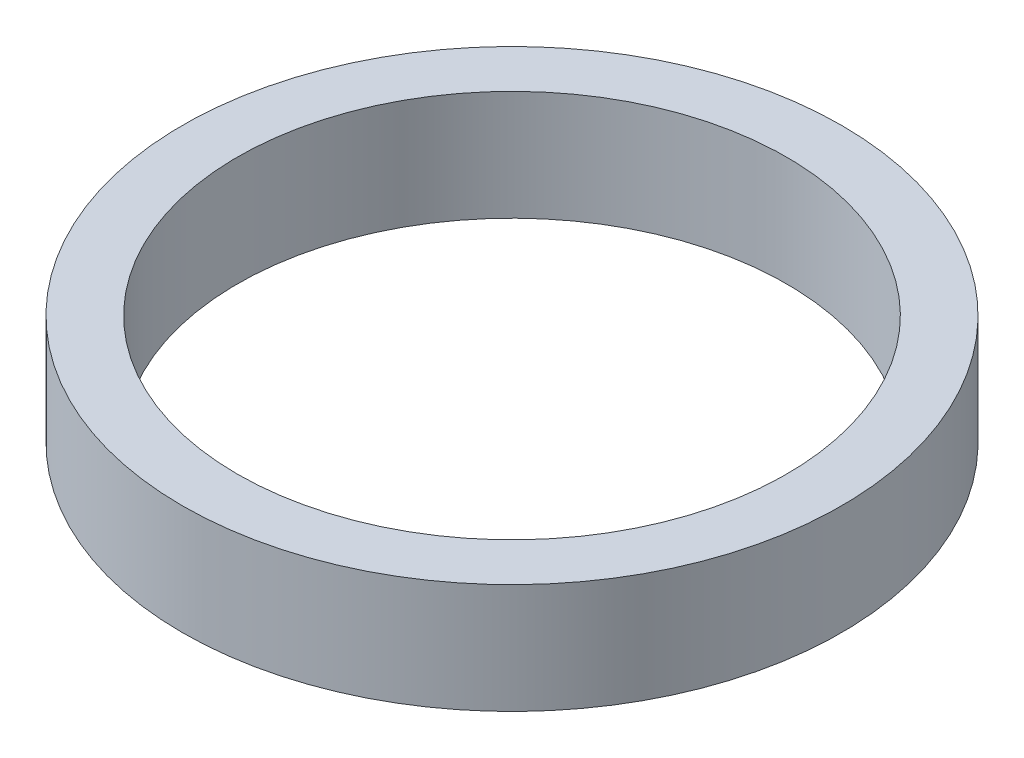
SolidWorks part; units mm, degrees
ref_plane "Plan de face" through (0, 0, 0) normal (0, 0, 1) x (1, 0, 0)
ref_plane "Plan de dessus" through (0, 0, 0) normal (0, 1, 0) x (1, 0, 0)
ref_plane "Plan de droite" through (0, 0, 0) normal (1, 0, 0) x (0, 0, -1)
sketch "Esquisse1" plane through (0, 0, 0) normal (0, 1, 0) x (1, 0, 0)
  circle A0 centre (0, 0) radius 30
  circle A1 centre (0, 0) radius 25
  dimension "D1" = 60
  dimension "D2" = 50
extrude "Extrusion1" add sketch "Esquisse1" along normal blind 10
